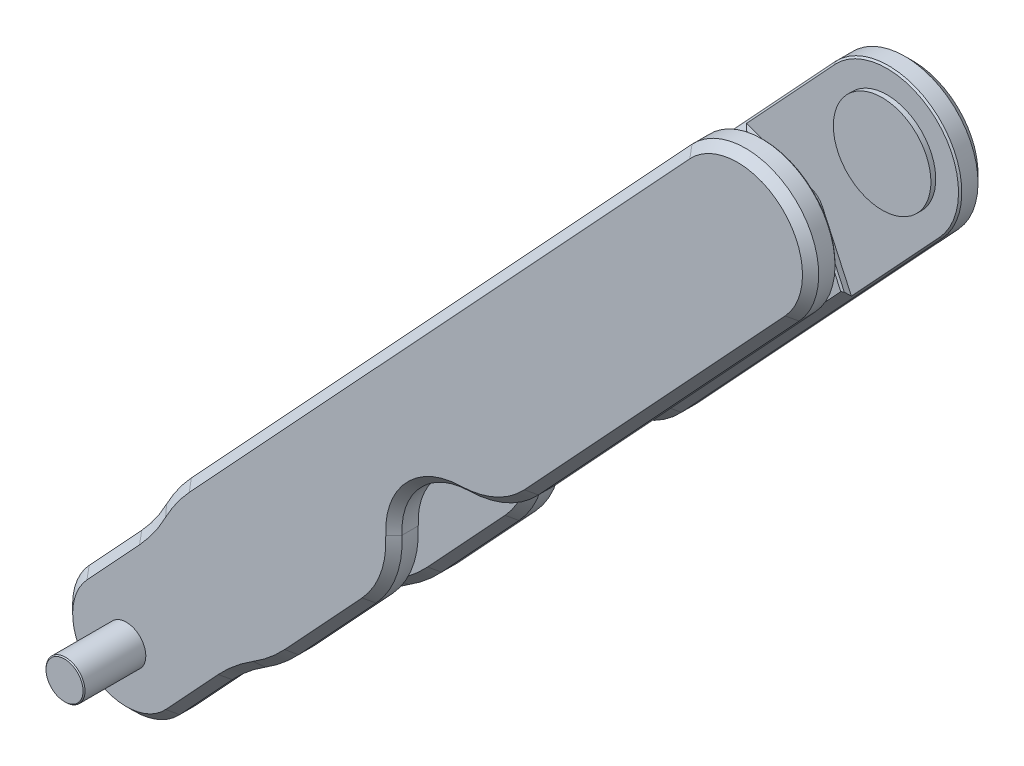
SolidWorks part; units mm, degrees
ref_plane "Front" through (0, 0, 0) normal (0, 0, 1) x (1, 0, 0)
ref_plane "Top" through (0, 0, 0) normal (0, 1, 0) x (1, 0, 0)
ref_plane "Right" through (0, 0, 0) normal (1, 0, 0) x (0, 0, -1)
imported_body "Defeature ausgeführt11"
imported_body "Defeature ausgeführt12"
imported_body "Defeature ausgeführt13"
imported_body "Defeature ausgeführt14"
imported_body "Defeature ausgeführt15"
imported_body "Defeature ausgeführt16"
other "Fläche löschen1"
other "Fläche löschen2"
other "Fläche löschen3"
other "Fläche löschen4"
